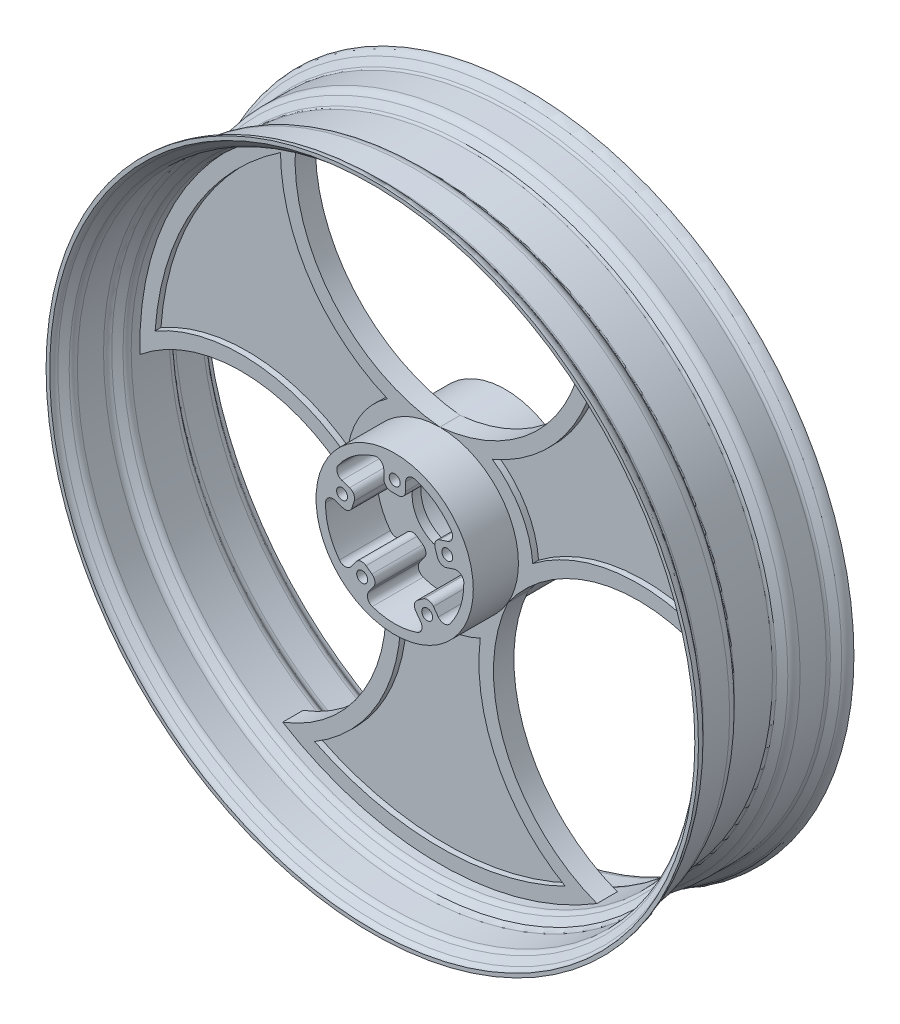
SolidWorks part; units mm, degrees
ref_plane "Front Plane" through (0, 0, 0) normal (0, 0, 1) x (1, 0, 0)
ref_plane "Top Plane" through (0, 0, 0) normal (0, 1, 0) x (1, 0, 0)
ref_plane "Right Plane" through (0, 0, 0) normal (1, 0, 0) x (0, 0, -1)
sketch "Sketch1" plane through (0, 0, 0) normal (1, 0, 0) x (0, 0, -1)
  line L0 (0, -43.656) -> (0, 52.7644) construction
  line L1 (-82.2601, 0) -> (72.9988, 0) construction
  line L2 (-38, 0) -> (38, 0)
  line L4 (-38, 0) -> (-38, 54)
  line L5 (38, 54) -> (7, 54)
  line L6 (-38, 54) -> (-7, 54)
  line L7 (7, 206) -> (7, 54)
  line L8 (-7, 206) -> (-7, 54)
  line L9 (7, 206) -> (13, 206)
  line L28 (38, 54) -> (38, 0)
  line L29 (16.8302, 207.7861) -> (20.3656, 211.9993)
  line L30 (24.1958, 213.7854) -> (42.1958, 213.7854)
  line L31 (46.026, 215.5714) -> (49.5613, 219.7847)
  line L32 (53.3916, 221.5707) -> (53.3916, 224.0707)
  line L33 (-7, 206) -> (-13, 206)
  line L34 (-16.8302, 207.7861) -> (-20.3656, 211.9993)
  line L35 (-24.1958, 213.7854) -> (-42.1958, 213.7854)
  line L36 (-46.026, 215.5714) -> (-49.5613, 219.7847)
  line L37 (-53.3916, 221.5707) -> (-53.3916, 224.0707)
  line L38 (7, 208.5) -> (13, 208.5)
  line L39 (14.9151, 209.393) -> (18.4504, 213.6063)
  line L40 (24.1958, 216.2854) -> (42.1958, 216.2854)
  line L41 (44.1109, 217.1784) -> (47.6462, 221.3916)
  line L42 (-7, 208.5) -> (-13, 208.5)
  line L43 (-14.9151, 209.393) -> (-18.4504, 213.6063)
  line L44 (-24.1958, 216.2854) -> (-42.1958, 216.2854)
  line L45 (-44.1109, 217.1784) -> (-47.6462, 221.3916)
  line L46 (-7, 208.5) -> (7, 208.5)
  arc A16 (13, 206) -> (16.8302, 207.7861) centre (13, 211) ccw
  arc A17 (20.3656, 211.9993) -> (24.1958, 213.7854) centre (24.1958, 208.7854) cw
  arc A18 (42.1958, 213.7854) -> (46.026, 215.5714) centre (42.1958, 218.7854) ccw
  arc A19 (49.5613, 219.7847) -> (53.3916, 221.5707) centre (53.3916, 216.5707) cw
  arc A20 (-13, 206) -> (-16.8302, 207.7861) centre (-13, 211) cw
  arc A21 (-20.3656, 211.9993) -> (-24.1958, 213.7854) centre (-24.1958, 208.7854) ccw
  arc A22 (-42.1958, 213.7854) -> (-46.026, 215.5714) centre (-42.1958, 218.7854) cw
  arc A23 (-49.5613, 219.7847) -> (-53.3916, 221.5707) centre (-53.3916, 216.5707) ccw
  arc A24 (13, 208.5) -> (14.9151, 209.393) centre (13, 211) ccw
  arc A25 (18.4504, 213.6063) -> (24.1958, 216.2854) centre (24.1958, 208.7854) cw
  arc A26 (42.1958, 216.2854) -> (44.1109, 217.1784) centre (42.1958, 218.7854) ccw
  arc A27 (47.6462, 221.3916) -> (53.3916, 224.0707) centre (53.3916, 216.5707) cw
  arc A28 (-13, 208.5) -> (-14.9151, 209.393) centre (-13, 211) cw
  arc A29 (-18.4504, 213.6063) -> (-24.1958, 216.2854) centre (-24.1958, 208.7854) ccw
  arc A30 (-42.1958, 216.2854) -> (-44.1109, 217.1784) centre (-42.1958, 218.7854) cw
  arc A31 (-47.6462, 221.3916) -> (-53.3916, 224.0707) centre (-53.3916, 216.5707) ccw
  point P9 (0, 0)
  point P26 (51.2785, 221.1023)
  point P37 (-51.2785, 221.1023)
  point P41 (-47.6462, 221.3916)
  dimension "D4" = 6
  dimension "D5" = 5
  dimension "D3" = 54
  dimension "D6" = 152
  dimension "D7" = 5.5
  dimension "D17" = 7.7854
  dimension "D9" = 5
  dimension "D12" = 5
  dimension "D14" = 5
  dimension "D2" = 31
  dimension "D8" = 50
  dimension "D10" = 76
  dimension "D11" = 18
  dimension "D13" = 5.5
  dimension "D15" = 2.5
  dimension "D16" = 7.7854
  dimension "D18" = 106.7831
  dimension "D19" = 412
revolve "Revolve2" add sketch "Sketch1" angle 360 about L1
sketch "Sketch2" plane through (0, 0, 7) normal (0, 0, 1) x (1, 0, 0)
  line L0 (0, 0) -> (0, 274.1317) construction
  line L1 (0, 274.1317) -> (0, 54) construction
  circle A0 centre (0, 0) radius 54 construction
  arc A2 (0, 54) -> (98, 181.196) centre (-10.5659, 163.4914) ccw
  circle A5 centre (0, 0) radius 206 construction
  arc A6 (0, 54) -> (-98, 181.196) centre (10.5659, 163.4914) cw
  arc A7 (98, 181.196) -> (-98, 181.196) centre (0, 0) ccw
  dimension "D1" = 412
  dimension "D2" = 110
  dimension "D3" = 110
  dimension "D4" = 196
extrude "Cut-Extrude1" cut sketch "Sketch2" against normal up to next contours A6 A7 A2
pattern_circular "CirPattern1" count 3 over 360 about axis through (0, 0, 0) along (0, 0, 1) of "Cut-Extrude1"
sketch "Sketch3" plane through (0, 0, 7) normal (0, 0, 1) x (1, 0, 0)
  line L0 (0, 0) -> (-300.4109, 173.4423) construction
  line L1 (0, 0) -> (0, 278.7325) construction
  line L2 (-109.4309, 162.6065) -> (0, 0) construction
  line L3 (0, 0) -> (-195.5368, 13.4667) construction
  arc A8 (-109.4309, 162.6065) -> (-195.5368, 13.4667) centre (0, 0) ccw
  arc A9 (-63.8241, 4.7416) -> (-195.5368, 13.4667) centre (-136.3048, -90.896) ccw
  arc A10 (-36.0184, 52.9025) -> (-63.8241, 4.7416) centre (0, 0) ccw
  arc A11 (-109.4309, 162.6065) -> (-36.0184, 52.9025) centre (10.5659, 163.4914) ccw
  arc A12 (-109.4309, 162.6065) -> (-195.5368, 13.4667) centre (0, 0) ccw
  arc A13 (-63.8241, 4.7416) -> (-195.5368, 13.4667) centre (-136.3048, -90.896) ccw
  arc A14 (-36.0184, 52.9025) -> (-63.8241, 4.7416) centre (0, 0) ccw
  arc A15 (-109.4309, 162.6065) -> (-36.0184, 52.9025) centre (10.5659, 163.4914) ccw
  dimension "D3" = 196
  dimension "D4" = 120
  dimension "D5" = 64
  dimension "D1" = 60
  dimension "D6" = 52.12
  dimension "D2" = 10
extrude "Cut-Extrude2" cut sketch "Sketch3" against normal blind 4
pattern_circular "CirPattern2" count 3 over 360 about axis through (0, 0, 0) along (0, 0, 1) of "Cut-Extrude2"
mirror "Mirror1" about plane through (0, 0, 0) normal (0, 0, 1) of "CirPattern2", "Cut-Extrude2"
sketch "Sketch4" plane through (0, 0, 38) normal (0, 0, 1) x (1, 0, 0)
  circle A0 centre (0, 0) radius 47.5
  dimension "D1" = 95
extrude "Cut-Extrude3" cut sketch "Sketch4" against normal up to surface (35 mm away)
mirror "Mirror2" about plane through (0, 0, 0) normal (0, 0, 1) of "Cut-Extrude3"
sketch "Sketch5" plane through (0, 0, 3) normal (0, 0, 1) x (1, 0, 0)
  circle A0 centre (0, 0) radius 23
  dimension "D1" = 46
extrude "Cut-Extrude4" cut sketch "Sketch5" against normal up to next
sketch "Sketch6" plane through (0, 0, 38) normal (0, 0, 1) x (1, 0, 0)
  line L0 (0, 0) -> (0, 74.8728) construction
  line L2 (-7.5, 30) -> (7.5, 30)
  line L3 (-7.5, 30) -> (-7.5, 46.9042)
  line L5 (7.5, 30) -> (7.5, 46.9042)
  line L6 (-7.5, 30) -> (7.5, 46.9042) construction
  line L7 (-7.5, 46.9042) -> (7.5, 30) construction
  circle A0 centre (0, 0) radius 47.5 construction
  circle A1 centre (0, 0) radius 47.5 construction
  arc A2 (7.5, 46.9042) -> (-7.5, 46.9042) centre (0, 0) ccw
  point P3 (0, 38.4521)
  dimension "D1" = 15
  dimension "D2" = 30
extrude "Boss-Extrude3" add sketch "Sketch6" against normal up to next contours L5 A2 L3 L2
sketch "Sketch7" plane through (0, 0, 38) normal (0, 0, 1) x (1, 0, 0)
  circle A0 centre (0, 0) radius 38 construction
  circle A1 centre (0, 38) radius 3.75
  dimension "D1" = 76
  dimension "D2" = 7.5
extrude "Cut-Extrude5" cut sketch "Sketch7" against normal blind 25
pattern_circular "CirPattern3" count 5 over 360 about axis through (0, 0, 0) along (0, 0, 1) of "Boss-Extrude3", "Cut-Extrude5"
fillet "Fillet1" radius 5 20 edges at (21.5019, -42.3546, 20.5) (-21.5019, -42.3546, 20.5) (-42.2909, 21.6271, 20.5) (-33.6372, -33.5379, 20.5) (11.5659, -28.6789, 20.5) (33.6372, -33.5379, 20.5) (23.7012, -19.8621, 20.5) (-23.7012, -19.8621, 20.5) (-11.5659, -28.6789, 20.5) (-46.9261, 7.3613, 20.5) (-30.8493, 2.1376, 20.5) (-26.2141, 16.4034, 20.5) (42.2909, 21.6271, 20.5) (46.9261, 7.3613, 20.5) (30.8493, 2.1376, 20.5) (26.2141, 16.4034, 20.5) (-7.5, 30, 20.5) (-7.5, 46.9042, 20.5) (7.5, 30, 20.5) (7.5, 46.9042, 20.5)
